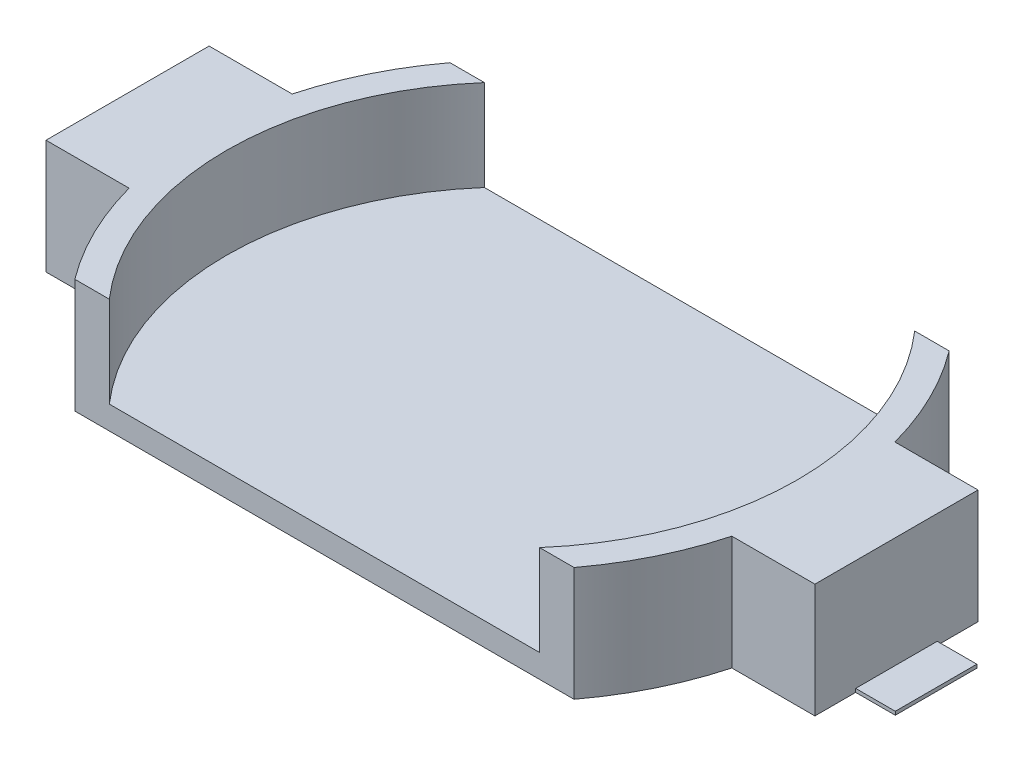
SolidWorks part; units mm, degrees
ref_plane "Front Plane" through (0, 0, 0) normal (0, 0, 1) x (1, 0, 0)
ref_plane "Top Plane" through (0, 0, 0) normal (0, 1, 0) x (1, 0, 0)
ref_plane "Right Plane" through (0, 0, 0) normal (1, 0, 0) x (0, 0, -1)
sketch "Sketch1" plane through (0, 0, 0) normal (0, 1, 0) x (1, 0, 0)
  circle A0 centre (0, 0) radius 13.4
  dimension "D1" = 26.8
extrude "Boss-Extrude1" add sketch "Sketch1" along normal blind 4.9
sketch "Sketch2" plane through (0, 4.9, 0) normal (0, 1, 0) x (1, 0, 0)
  circle A0 centre (0, 0) radius 12.25
  dimension "D1" = 24.5
extrude "Cut-Extrude1" cut sketch "Sketch2" against normal blind 3.9
sketch "Sketch3" plane through (0, 1, 0) normal (0, 1, 0) x (1, 0, 0)
  line L0 (0, 0) -> (17.6192, 0) construction
  line L1 (-24.8557, 8.05) -> (23.3455, 8.05)
  line L2 (-24.8557, 8.05) -> (-24.8557, -8.05)
  line L3 (-24.8557, -8.05) -> (23.3455, -8.05)
  line L4 (23.3455, 8.05) -> (23.3455, -8.05)
  dimension "D1" = 16.1
extrude "Cut-Extrude3" cut sketch "Sketch3" against normal mid plane 24.9 flip side to cut
sketch "Sketch4" plane through (0, 0, 0) normal (0, -1, 0) x (1, 0, 0)
  line L0 (0, 0) -> (-18.2342, 0) construction
  line L1 (-16.5, 3.5) -> (-12.9348, 3.5)
  line L2 (-16.5, 3.5) -> (-16.5, -3.5)
  line L3 (-16.5, -3.5) -> (-12.9348, -3.5)
  line L4 (-12.9348, 3.5) -> (-12.9348, -3.5)
  line L5 (16.5, 3.5) -> (12.9348, 3.5)
  line L6 (16.5, 3.5) -> (16.5, -3.5)
  line L7 (16.5, -3.5) -> (12.9348, -3.5)
  line L8 (12.9348, 3.5) -> (12.9348, -3.5)
  line L9 (0, 0) -> (0, -11.913) construction
  arc A0 (10.7125, -8.05) -> (10.7125, 8.05) centre (0, 0) ccw construction
  dimension "D1" = 7
  dimension "D2" = 7
  dimension "D3" = 33
extrude "Boss-Extrude3" add sketch "Sketch4" against normal blind 4.9
sketch "Sketch5" plane through (0, 0, 0) normal (0, -1, 0) x (1, 0, 0)
  line L0 (-16.5, 3.5) -> (-16.5, -3.5) construction
  line L1 (-16.5, 1.75) -> (-18.2, 1.75)
  line L2 (-16.5, 1.75) -> (-16.5, -1.75)
  line L3 (-16.5, -1.75) -> (-18.2, -1.75)
  line L4 (-18.2, 1.75) -> (-18.2, -1.75)
  line L5 (16.5, -3.5) -> (16.5, 3.5) construction
  line L6 (16.5, 1.75) -> (18.2, 1.75)
  line L7 (16.5, 1.75) -> (16.5, -1.75)
  line L8 (16.5, -1.75) -> (18.2, -1.75)
  line L9 (18.2, 1.75) -> (18.2, -1.75)
  line L10 (0, 0) -> (0, -10.0288) construction
  line L11 (0, 0) -> (-19.7083, 0) construction
  dimension "D1" = 36.4
  dimension "D2" = 3.5
  dimension "D3" = 3.5
extrude "Boss-Extrude4" add sketch "Sketch5" against normal blind 0.15
